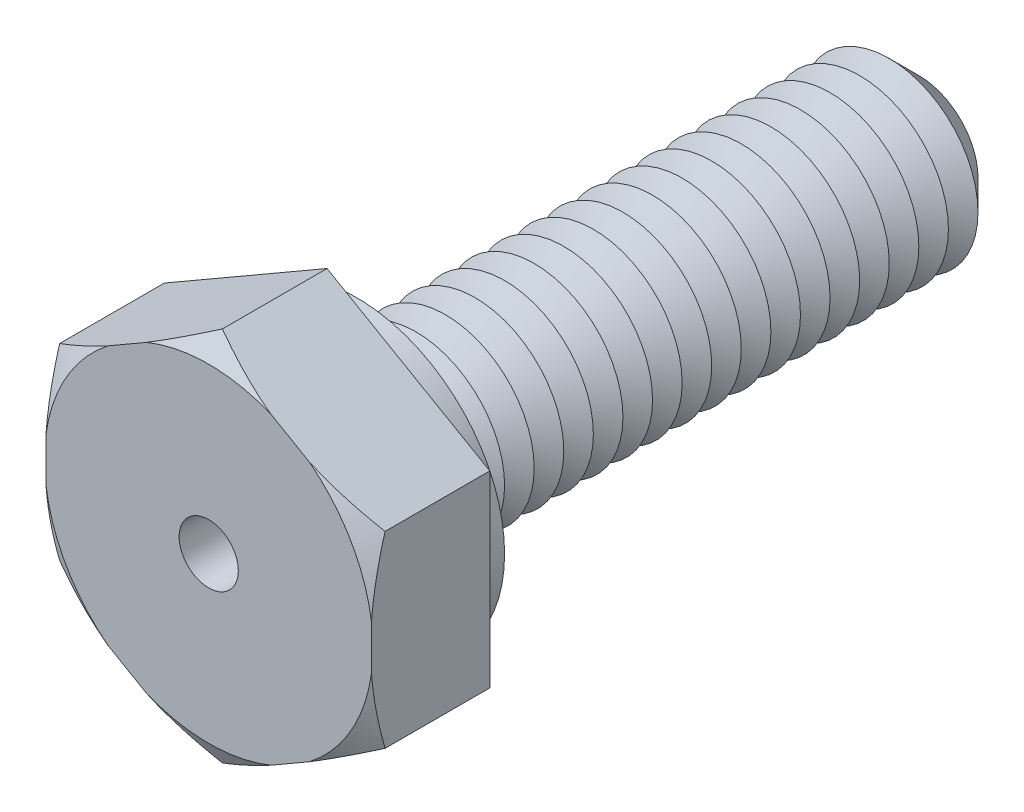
SolidWorks part; units mm, degrees
ref_plane "Front Plane" through (0, 0, 0) normal (0, 0, 1) x (1, 0, 0)
ref_plane "Top Plane" through (0, 0, 0) normal (0, 1, 0) x (1, 0, 0)
ref_plane "Right Plane" through (0, 0, 0) normal (1, 0, 0) x (0, 0, -1)
sketch "Sketch2" plane through (0, 0, 0) normal (0, 0, 1) x (1, 0, 0)
  line L1 (0, 3.1754) -> (-2.75, 1.5877)
  line L2 (-2.75, 1.5877) -> (-2.75, -1.5877)
  line L3 (-2.75, -1.5877) -> (0, -3.1754)
  line L4 (0, -3.1754) -> (2.75, -1.5877)
  line L5 (2.75, -1.5877) -> (2.75, 1.5877)
  line L6 (2.75, 1.5877) -> (0, 3.1754)
  circle A0 centre (0, 0) radius 2.75 construction
  dimension "D1" = 5.5
extrude "Boss-Extrude1" add sketch "Sketch2" along normal blind 2
sketch "Sketch3" plane through (0, 0, 0) normal (0, 0, -1) x (-1, 0, 0)
  circle A0 centre (0, 0) radius 1.5
  dimension "D1" = 3
extrude "Boss-Extrude2" add sketch "Sketch3" along normal blind 10
sketch "Sketch4" plane through (0, 0, 0) normal (0, 0, -1) x (-1, 0, 0)
  circle A0 centre (0, 0) radius 2.5
  dimension "D1" = 5
extrude "Boss-Extrude3" add sketch "Sketch4" along normal blind 0.5
sketch "Sketch5" plane through (0, 0, 0) normal (1, 0, 0) x (0, 0, -1)
  line L0 (-3.2117, 0) -> (6.3192, 0) construction
chamfer "Chamfer1" distance 0.5 angle 45 1 edges at (-1.5, 0, -10)
sketch "Sketch6" plane through (0, 0, 0) normal (1, 0, 0) x (0, 0, -1)
  line L0 (0.5, 1.5) -> (0.75, 1.067)
  line L1 (0.75, 1.067) -> (1, 1.5)
  line L2 (9.5, 1.5) -> (0.5, 1.5) construction
  line L3 (1, 1.5) -> (0.5, 1.5)
  dimension "D1" = 0.5
revolve "Cut-Revolve1" cut sketch "Sketch6" angle 360 about L0
pattern_linear "LPattern1" count 18 spacing 0.5 along (0, 0, -1) of "Cut-Revolve1"
sketch "Sketch7" plane through (0, 0, 0) normal (1, 0, 0) x (0, 0, -1)
  line L0 (-2, 3.1754) -> (-2, 2.7754)
  line L1 (-2, 1.5877) -> (-2, 3.1754) construction
  line L2 (-2, 2.7754) -> (-1.7691, 3.1754)
  line L3 (-2, 3.1754) -> (0, 3.1754) construction
  line L4 (-1.7691, 3.1754) -> (-2, 3.1754)
  dimension "D1" = 0.4
  dimension "D2" = 30
revolve "Cut-Revolve2" cut sketch "Sketch7" angle 360 about L0
sketch "Sketch8" plane through (0, 0, 2) normal (0, 0, 1) x (1, 0, 0)
  circle A0 centre (0, 0) radius 0.5
  dimension "D1" = 1
extrude "Cut-Extrude1" cut sketch "Sketch8" against normal up to surface (12 mm away)
